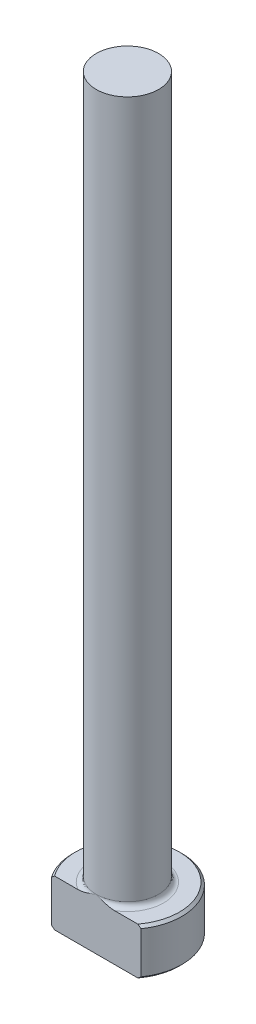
SolidWorks part; units mm, degrees
ref_plane "Front Plane" through (0, 0, 0) normal (0, 0, 1) x (1, 0, 0)
ref_plane "Top Plane" through (0, 0, 0) normal (0, 1, 0) x (1, 0, 0)
ref_plane "Right Plane" through (0, 0, 0) normal (1, 0, 0) x (0, 0, -1)
sketch "Sketch1" plane through (0, 0, 0) normal (0, 0, 1) x (1, 0, 0)
  line L0 (0, 259.9588) -> (0, -15.1925) construction
  line L1 (0, 0) -> (-5.5499, 0)
  line L2 (-5.5499, 0) -> (-5.5499, 4.7498)
  line L3 (-5.5499, 4.7498) -> (-3.175, 4.7498)
  line L4 (-3.175, 4.7498) -> (-3.175, 76.2)
  line L5 (-3.175, 76.2) -> (0, 76.2)
  line L6 (0, 76.2) -> (0, 0)
  dimension "L" = 76.2
  dimension "H" = 11.0998
  dimension "T" = 4.7498
  dimension "D" = 6.35
revolve "Revolve1" add sketch "Sketch1" angle 360 about L0
chamfer "Chamfer1" distance 0.254 angle 45 2 edges at (0, 4.7498, 5.5499) (0, 0, 5.5499)
fillet "Fillet1" radius 0.508 1 edges at (0, 4.7498, 3.175)
sketch "Sketch2" plane through (0, 0, 0) normal (0, 1, 0) x (1, 0, 0)
  line L0 (-4.552, -3.175) -> (4.552, -3.175)
  circle A0 centre (0, 0) radius 5.5499 construction
  arc A1 (-4.552, -3.175) -> (4.552, -3.175) centre (0, 0) ccw
  circle A3 centre (0, 0) radius 3.175 construction
  dimension "D1" = 0
extrude "Key" cut sketch "Sketch2" along normal through all
sketch "Pocket Sketch" plane through (0, 0, 0) normal (0, 0, 1) x (1, 0, 0)
  line L0 (-5.9468, 0) -> (-5.9468, 4.7752)
  line L1 (-5.9468, 4.7752) -> (-4.3339, 4.7752)
  line L2 (-3.5719, 5.5372) -> (-3.5719, 22.225)
  line L3 (-3.5719, 22.225) -> (0, 22.225)
  line L4 (0, 22.225) -> (0, 0)
  line L5 (0, 0) -> (-5.9468, 0)
  line L6 (0, 12.6104) -> (0, -2.4989) construction
  line L7 (-5.5499, 4.4958) -> (-5.5499, 0.254) construction
  line L8 (5.2959, 4.7498) -> (-5.2959, 4.7498) construction
  line L9 (-3.175, 76.2) -> (-3.175, 5.2578) construction
  line L10 (-4.3339, 4.7752) -> (-3.5719, 5.5372)
  point P3 (-3.5719, 4.7752)
  dimension "D1" = 11.8935
  dimension "D2" = 0.3969
  dimension "D3" = 0.0254
  dimension "D4" = 0.3969
  dimension "D5" = 7.1437
  dimension "D6" = 22.225
